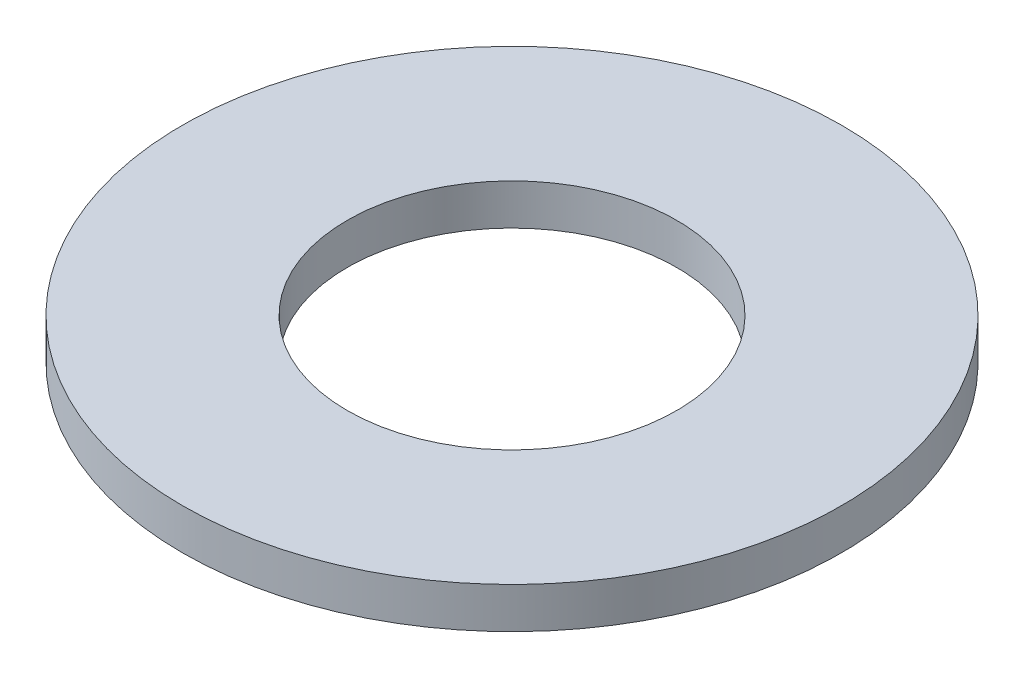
SolidWorks part; units mm, degrees
ref_plane "Front" through (0, 0, 0) normal (0, 0, 1) x (1, 0, 0)
ref_plane "Top" through (0, 0, 0) normal (0, 1, 0) x (1, 0, 0)
ref_plane "Right" through (0, 0, 0) normal (1, 0, 0) x (0, 0, -1)
sketch "Sketch1" plane through (0, 0, 0) normal (0, 1, 0) x (1, 0, 0)
  circle A0 centre (0, 0) radius 125
  circle A1 centre (0, 0) radius 250
  dimension "D1" = 250
  dimension "D2" = 500
extrude "Boss-Extrude1" add sketch "Sketch1" along normal blind 31
